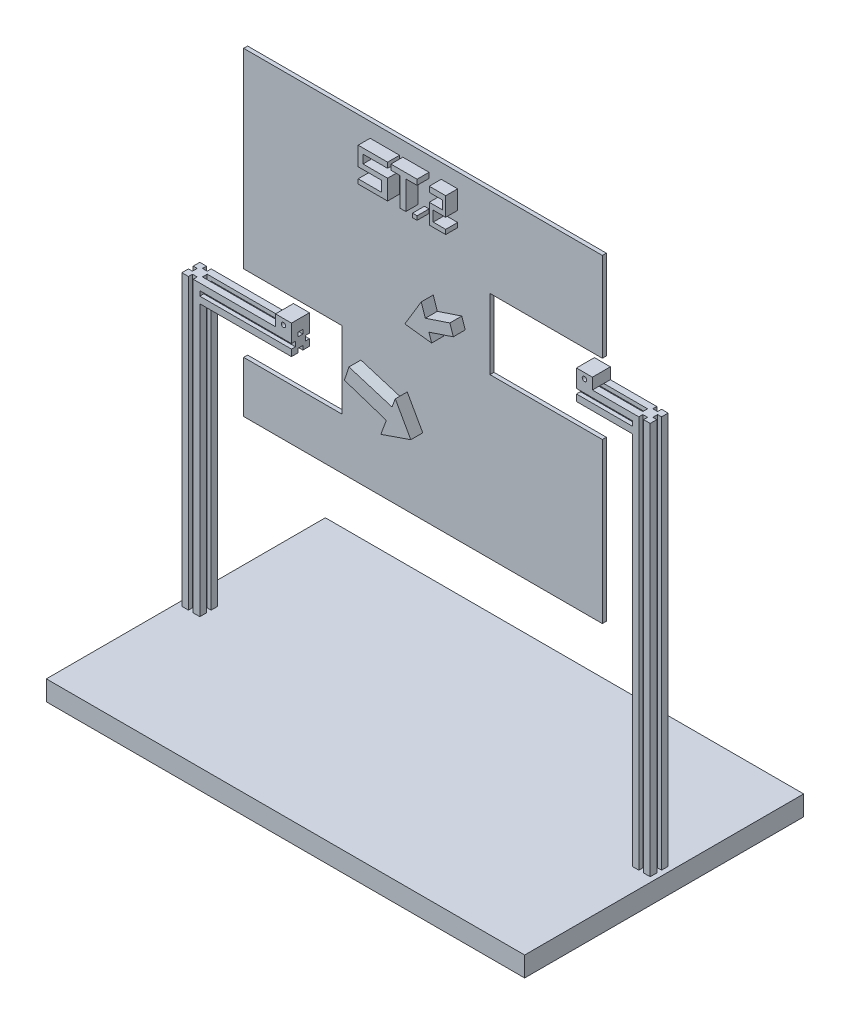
SolidWorks part; units mm, degrees
ref_plane "Front Plane" through (0, 0, 0) normal (0, 0, 1) x (1, 0, 0)
ref_plane "Top Plane" through (0, 0, 0) normal (0, 1, 0) x (1, 0, 0)
ref_plane "Right Plane" through (0, 0, 0) normal (1, 0, 0) x (0, 0, -1)
sketch "Schizzo1" plane through (0, 0, 0) normal (0, 1, 0) x (1, 0, 0)
  line L1 (-600, 350) -> (600, 350)
  line L2 (-600, 350) -> (-600, -350)
  line L3 (-600, -350) -> (600, -350)
  line L4 (600, 350) -> (600, -350)
  dimension "D1" = 1200
  dimension "D2" = 600
  dimension "D3" = 700
  dimension "D4" = 350
extrude "Estrusione-Estrusione1" add sketch "Schizzo1" along normal blind 50
sketch "Schizzo2" plane through (0, 50, 0) normal (0, 1, 0) x (1, 0, 0)
  line L0 (-600, -350) -> (600, -350) construction
  line L1 (-587.5, 22.5) -> (-542.5, 22.5)
  line L2 (-587.5, 22.5) -> (-587.5, -22.5)
  line L3 (-587.5, -22.5) -> (-542.5, -22.5)
  line L4 (-542.5, 22.5) -> (-542.5, -22.5)
  line L5 (471.3786, 22.5) -> (516.3786, 22.5)
  line L6 (471.3786, 22.5) -> (471.3786, -22.5)
  line L7 (471.3786, -22.5) -> (516.3786, -22.5)
  line L8 (516.3786, 22.5) -> (516.3786, -22.5)
  line L10 (-566.6655, 0) -> (-477.0291, 0) construction
  line L11 (-565, -38.8225) -> (-565, 33.5547) construction
  line L12 (-559, 22.5) -> (-559, 12.5)
  line L13 (-571, -22.5) -> (-559, -22.5)
  line L14 (-571, -22.5) -> (-571, -12.5)
  line L15 (-571, -12.5) -> (-559, -12.5)
  line L16 (-559, -22.5) -> (-559, -12.5)
  line L17 (-587.5, 6) -> (-577.5, 6)
  line L18 (-587.5, 6) -> (-587.5, -6)
  line L19 (-587.5, -6) -> (-577.5, -6)
  line L20 (-577.5, 6) -> (-577.5, -6)
  line L21 (-571, 22.5) -> (-571, 12.5)
  line L22 (-571, 12.5) -> (-559, 12.5)
  line L23 (-542.5, -6) -> (-552.5, -6)
  line L24 (-552.5, 6) -> (-552.5, -6)
  line L25 (-542.5, 6) -> (-552.5, 6)
  dimension "D1" = 45
  dimension "D2" = 45
  dimension "D3" = 45
  dimension "D4" = 45
  dimension "D5" = 327.5
  dimension "D6" = 327.5
  dimension "D7" = 22.5
  dimension "D8" = 12
  dimension "D9" = 6
  dimension "D10" = 10
  dimension "D11" = 10
  dimension "D12" = 12
  dimension "D13" = 6
  dimension "D14" = 587.5
extrude "Estrusione-Estrusione2" add sketch "Schizzo2" along normal blind 680 and the other way blind 45 from offset 45 separate body contours L25 L4 L1 L12 L22 L21 L2 L17 L20 L19 L3 L14 L15 L16 L23 L24
sketch "Schizzo3" plane through (0, 50, 0) normal (0, 1, 0) x (1, 0, 0)
  line L0 (-600, -350) -> (600, -350) construction
  line L1 (542.5, 22.5) -> (587.5, 22.5)
  line L2 (542.5, 22.5) -> (542.5, -22.5)
  line L3 (542.5, -22.5) -> (587.5, -22.5)
  line L4 (587.5, 22.5) -> (587.5, -22.5)
  line L5 (565, 30.9791) -> (565, -29.5813) construction
  line L6 (530.3703, 0) -> (597.2458, 0) construction
  line L7 (542.5, -6) -> (552.5, -6)
  line L8 (559, -22.5) -> (571, -22.5)
  line L9 (559, -22.5) -> (559, -12.5)
  line L10 (559, -12.5) -> (571, -12.5)
  line L11 (571, -22.5) -> (571, -12.5)
  line L12 (587.5, 6) -> (577.5, 6)
  line L13 (587.5, 6) -> (587.5, -6)
  line L14 (587.5, -6) -> (577.5, -6)
  line L15 (577.5, 6) -> (577.5, -6)
  line L16 (552.5, 6) -> (552.5, -6)
  line L17 (542.5, 6) -> (552.5, 6)
  line L18 (571, 22.5) -> (571, 12.5)
  line L19 (559, 12.5) -> (571, 12.5)
  line L20 (559, 22.5) -> (559, 12.5)
  dimension "D1" = 45
  dimension "D2" = 45
  dimension "D3" = 587.5
  dimension "D4" = 327.5
  dimension "D5" = 22.5
  dimension "D6" = 22.5
  dimension "D7" = 12
  dimension "D8" = 10
  dimension "D9" = 10
  dimension "D10" = 12
  dimension "D11" = 6
  dimension "D12" = 6
extrude "Estrusione-Estrusione3" add sketch "Schizzo3" along normal blind 985 separate body contours L20 L1 L2 L17 L16 L7 L3 L9 L10 L11 L4 L14 L15 L12 L18 L19
sketch "Schizzo4" plane through (-542.5, 0, 0) normal (1, 0, 0) x (0, 0, -1)
  line L0 (22.5, 50) -> (22.5, 775) construction
  line L1 (-22.5, 775) -> (22.5, 775)
  line L2 (-22.5, 775) -> (-22.5, 730)
  line L3 (-22.5, 730) -> (22.5, 730)
  line L4 (22.5, 775) -> (22.5, 730)
  line L5 (6, 50) -> (6, 775) construction
  line L6 (-22.5, 758.5) -> (-12.5, 758.5)
  line L7 (-22.5, 758.5) -> (-22.5, 746.5)
  line L8 (-22.5, 746.5) -> (-12.5, 746.5)
  line L9 (-12.5, 758.5) -> (-12.5, 746.5)
  line L10 (22.5, 758.5) -> (12.5, 758.5)
  line L11 (22.5, 758.5) -> (22.5, 746.5)
  line L12 (22.5, 746.5) -> (12.5, 746.5)
  line L13 (12.5, 758.5) -> (12.5, 746.5)
  line L14 (-6, 775) -> (6, 775)
  line L15 (-6, 775) -> (-6, 765)
  line L16 (-6, 765) -> (6, 765)
  line L17 (6, 775) -> (6, 765)
  line L18 (-6, 50) -> (-6, 775) construction
  line L19 (-6, 730) -> (6, 730)
  line L20 (-6, 730) -> (-6, 740)
  line L21 (-6, 740) -> (6, 740)
  line L22 (6, 730) -> (6, 740)
  dimension "D1" = 45
  dimension "D2" = 10
  dimension "D3" = 12
  dimension "D4" = 10
  dimension "D5" = 12
  dimension "D6" = 10
  dimension "D7" = 10
  dimension "D8" = 16.5
  dimension "D9" = 16.5
extrude "Estrusione-Estrusione4" add sketch "Schizzo4" along normal blind 230 contours L22 L3 L4 L12 L13 L10 L1 L17 L16 L21 M1 | L6 L9 L8 L3 M3 M1 M2
sketch "Schizzo5" plane through (0, 775, 0) normal (0, 1, 0) x (1, 0, 0)
  line L0 (-559, -22.5) -> (-312.5, -22.5) construction
  line L1 (-312.5, 22.5) -> (-352.5, 22.5)
  line L2 (-312.5, 22.5) -> (-312.5, -22.5)
  line L3 (-312.5, -22.5) -> (-352.5, -22.5)
  line L4 (-352.5, 22.5) -> (-352.5, -22.5)
  dimension "D1" = 40
extrude "Estrusione-Estrusione5" add sketch "Schizzo5" along normal blind 28
sketch "Schizzo6" plane through (0, 0, 22.5) normal (0, 0, 1) x (1, 0, 0)
  line L0 (-352.5, 803) -> (-312.5, 803) construction
  line L1 (-352.5, 803) -> (-352.5, 775) construction
  circle A0 centre (-332.5, 789) radius 5.5
  dimension "D1" = 11
  dimension "D2" = 14
  dimension "D3" = 20
extrude "Taglio-Estrusione1" cut sketch "Schizzo6" against normal blind 45
sketch "Schizzo7" plane through (542.5, 0, 0) normal (-1, 0, 0) x (0, 0, 1)
  line L0 (22.5, 1035) -> (22.5, 50) construction
  line L1 (-22.5, 1035) -> (22.5, 1035)
  line L2 (-22.5, 1035) -> (-22.5, 990)
  line L3 (-22.5, 990) -> (22.5, 990)
  line L4 (22.5, 1035) -> (22.5, 990)
  line L5 (6, 1035) -> (6, 50) construction
  line L6 (22.5, 1018.5) -> (12.5, 1018.5)
  line L7 (22.5, 1018.5) -> (22.5, 1006.5)
  line L8 (22.5, 1006.5) -> (12.5, 1006.5)
  line L9 (12.5, 1018.5) -> (12.5, 1006.5)
  line L10 (-22.5, 1018.5) -> (-12.5, 1018.5)
  line L11 (-22.5, 1018.5) -> (-22.5, 1006.5)
  line L12 (-22.5, 1006.5) -> (-12.5, 1006.5)
  line L13 (-12.5, 1018.5) -> (-12.5, 1006.5)
  line L14 (-6, 1035) -> (6, 1035)
  line L15 (-6, 1035) -> (-6, 1025)
  line L16 (-6, 1025) -> (6, 1025)
  line L17 (6, 1035) -> (6, 1025)
  line L18 (-6, 1035) -> (-6, 50) construction
  line L19 (-6, 990) -> (6, 990)
  line L20 (-6, 990) -> (-6, 1000)
  line L21 (-6, 1000) -> (6, 1000)
  line L22 (6, 990) -> (6, 1000)
  dimension "D1" = 45
  dimension "D2" = 10
  dimension "D3" = 10
  dimension "D4" = 12
  dimension "D5" = 12
  dimension "D6" = 10
  dimension "D7" = 10
  dimension "D8" = 16.5
  dimension "D9" = 16.5
extrude "Estrusione-Estrusione6" add sketch "Schizzo7" along normal blind 140 contours L9 L6 L4 L3 L8 M3 M4 M2 | L20 L21 L16 L15 L1 L2 L10 L13 L12 L3 M4
sketch "Schizzo8" plane through (0, 1035, 0) normal (0, 1, 0) x (1, 0, 0)
  line L0 (402.5, -22.5) -> (559, -22.5) construction
  line L1 (402.5, 22.5) -> (442.5, 22.5)
  line L2 (402.5, 22.5) -> (402.5, -22.5)
  line L3 (402.5, -22.5) -> (442.5, -22.5)
  line L4 (442.5, 22.5) -> (442.5, -22.5)
  dimension "D1" = 40
extrude "Estrusione-Estrusione7" add sketch "Schizzo8" along normal blind 28
sketch "Schizzo9" plane through (0, 0, 22.5) normal (0, 0, 1) x (1, 0, 0)
  line L0 (442.5, 1063) -> (442.5, 1035) construction
  line L1 (402.5, 1063) -> (442.5, 1063) construction
  circle A0 centre (422.5, 1049) radius 5.5
  dimension "D1" = 11
  dimension "D2" = 20
  dimension "D3" = 14
extrude "Taglio-Estrusione2" cut sketch "Schizzo9" against normal blind 45
sketch "Schizzo10" plane through (0, 0, 22.5) normal (0, 0, 1) x (1, 0, 0)
  line L0 (-600, 50) -> (600, 50) construction
  line L1 (-422.5523, 1350) -> (477.4477, 1350)
  line L2 (-422.5523, 1350) -> (-422.5523, 870.8352)
  line L3 (-422.5523, 550) -> (477.4477, 550)
  line L4 (477.4477, 1350) -> (477.4477, 1126.471)
  line L5 (477.4477, 1126.471) -> (195.4244, 1126.471)
  line L6 (195.4244, 1126.471) -> (195.4244, 950)
  line L7 (195.4244, 950) -> (477.4477, 950)
  line L8 (-422.5523, 870.8352) -> (-175.1303, 870.8352)
  line L9 (-175.1303, 870.8352) -> (-175.1303, 678.522)
  line L10 (-175.1303, 678.522) -> (-422.5523, 678.522)
  line L11 (477.4477, 950) -> (477.4477, 550)
  line L12 (-422.5523, 678.522) -> (-422.5523, 550)
  dimension "D1" = 1300
  dimension "D2" = 800
  dimension "D3" = 900
extrude "Estrusione-Estrusione8" add sketch "Schizzo10" along normal blind 10 separate body
sketch "Schizzo11" plane through (0, 0, 32.5) normal (0, 0, 1) x (1, 0, 0)
  line L0 (-105.1452, 1313.2239) -> (-31.39, 1313.2239)
  line L1 (-31.39, 1313.2239) -> (-31.39, 1299.8139)
  line L2 (-31.39, 1299.8139) -> (-93.0762, 1299.8139)
  line L3 (-93.0762, 1299.8139) -> (-93.0762, 1278.3578)
  line L4 (-93.0762, 1278.3578) -> (-31.39, 1278.3578)
  line L5 (-31.39, 1278.3578) -> (-31.39, 1228.7408)
  line L6 (-31.39, 1228.7408) -> (-105.1452, 1228.7408)
  line L7 (0, 1228.7408) -> (14.3592, 1228.7408)
  line L8 (-105.1452, 1240.1393) -> (-46.1411, 1240.1393)
  line L9 (-46.1411, 1240.1393) -> (-46.1411, 1266.2888)
  line L10 (-46.1411, 1266.2888) -> (-105.1452, 1266.2888)
  line L11 (-105.1452, 1313.2239) -> (-105.1452, 1266.2888)
  line L12 (-105.1452, 1240.1393) -> (-105.1452, 1228.7408)
  line L13 (14.3592, 1228.7408) -> (14.3592, 1299.8139)
  line L14 (14.3592, 1299.8139) -> (42.6162, 1299.8139)
  line L15 (42.6162, 1299.8139) -> (42.6162, 1313.2239)
  line L16 (42.6162, 1313.2239) -> (-23.0621, 1313.2239)
  line L17 (-23.0621, 1313.2239) -> (-23.0621, 1299.8139)
  line L18 (-23.0621, 1299.8139) -> (0, 1299.8139)
  line L19 (0, 1299.8139) -> (0, 1228.7408)
  line L20 (73.1642, 1313.2239) -> (73.1642, 1299.8139)
  line L21 (31.1606, 1233.719) -> (42.6162, 1233.719)
  line L22 (31.1606, 1233.719) -> (31.1606, 1223.7909)
  line L23 (31.1606, 1223.7909) -> (42.6162, 1223.7909)
  line L24 (42.6162, 1233.719) -> (42.6162, 1223.7909)
  line L25 (73.1642, 1299.8139) -> (106.767, 1299.8139)
  line L26 (106.767, 1299.8139) -> (106.767, 1278.3578)
  line L27 (106.767, 1278.3578) -> (73.1642, 1278.3578)
  line L28 (73.1642, 1278.3578) -> (73.1642, 1228.7408)
  line L29 (73.1642, 1228.7408) -> (114.404, 1228.7408)
  line L31 (114.404, 1240.1393) -> (83.0923, 1240.1393)
  line L32 (83.0923, 1240.1393) -> (83.0923, 1266.2888)
  line L33 (83.0923, 1266.2888) -> (114.404, 1266.2888)
  line L34 (114.404, 1266.2888) -> (114.404, 1313.2239)
  line L35 (114.404, 1313.2239) -> (73.1642, 1313.2239)
  line L36 (114.404, 1228.7408) -> (114.404, 1240.1393)
extrude "Estrusione-Estrusione9" add sketch "Schizzo11" along normal blind 30
sketch "Schizzo12" plane through (0, 0, 32.5) normal (0, 0, 1) x (1, 0, 0)
  line L0 (63.411, 1021.4711) -> (124.8195, 1041.9406)
  line L1 (124.8195, 1041.9406) -> (133.4347, 1016.095)
  line L2 (133.4347, 1016.095) -> (72.1633, 995.6712)
  line L3 (79.0599, 975.3411) -> (72.1633, 995.6712)
  line L4 (79.0599, 975.3411) -> (11.9351, 983.3992)
  line L5 (11.9351, 983.3992) -> (53.1019, 1051.8602)
  line L6 (63.411, 1021.4711) -> (53.1019, 1051.8602)
extrude "Estrusione-Estrusione10" add sketch "Schizzo12" along normal blind 30
sketch "Schizzo13" plane through (0, 0, 32.5) normal (0, 0, 1) x (1, 0, 0)
  line L0 (-139.7027, 785.243) -> (-34.4781, 750.6692)
  line L1 (-128.3428, 819.8168) -> (-20.3651, 786.8528)
  line L2 (-48.3291, 713.3475) -> (-34.4781, 750.6692)
  line L3 (-128.3428, 819.8168) -> (-139.7027, 785.243)
  line L4 (-12.0845, 808.6191) -> (-20.3651, 786.8528)
  line L5 (-48.3291, 713.3475) -> (26.8834, 739.2642)
  line L6 (26.8834, 739.2642) -> (-12.0845, 808.6191)
extrude "Estrusione-Estrusione11" add sketch "Schizzo13" along normal blind 30
